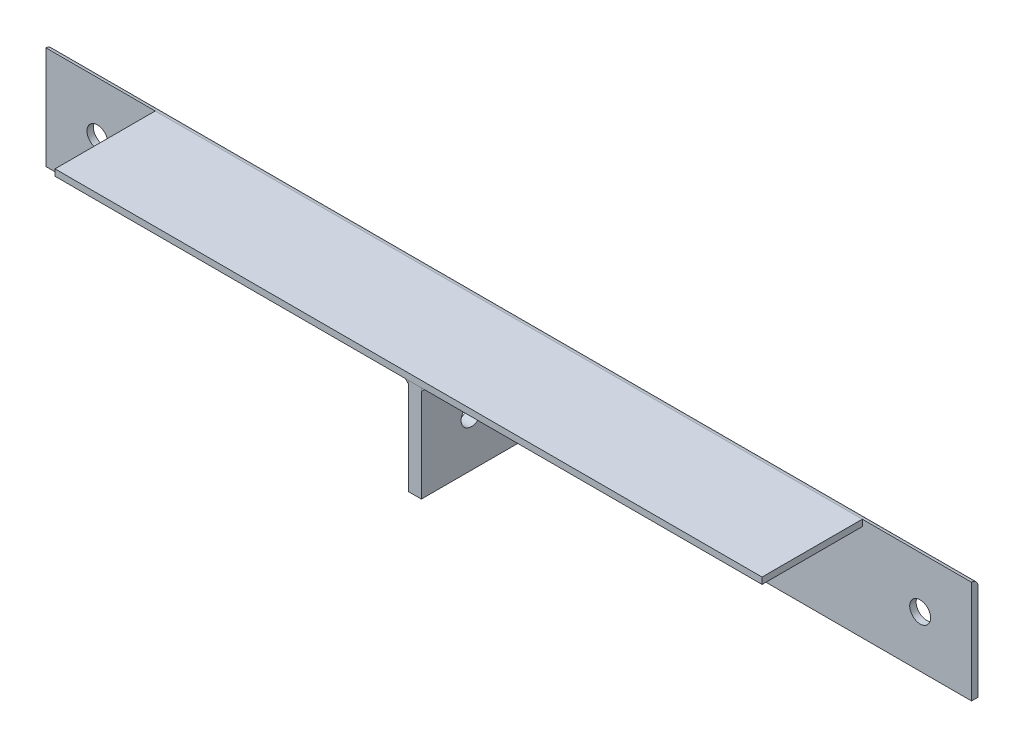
SolidWorks part; units mm, degrees
other "DetailItem1"
ref_plane "Front Plane" through (0, 0, 0) normal (0, 0, 1) x (1, 0, 0)
ref_plane "Top Plane" through (0, 0, 0) normal (0, 1, 0) x (1, 0, 0)
ref_plane "Right Plane" through (0, 0, 0) normal (1, 0, 0) x (0, 0, -1)
sketch "Sketch1" plane through (0, 0, 0) normal (0, 0, 1) x (1, 0, 0)
  line L1 (0, 0) -> (-914.4, 0)
  line L2 (0, 0) -> (0, -101.6)
  line L3 (0, -101.6) -> (-914.4, -101.6)
  line L4 (-914.4, 0) -> (-914.4, -101.6)
  dimension "D1" = 914.4
  dimension "D2" = 101.6
extrude "Extrude1" add sketch "Sketch1" along normal blind 6.35
sketch "Sketch2" plane through (0, 0, 6.35) normal (0, 0, 1) x (1, 0, 0)
  line L0 (0, -101.6) -> (0, 0) construction
  line L1 (0, 0) -> (-914.4, 0) construction
  circle A0 centre (-863.6, -50.8) radius 10.3188
  dimension "D1" = 20.6375
  dimension "D2" = 863.6
  dimension "D3" = 50.8
extrude "Cut-Extrude1" cut sketch "Sketch2" against normal blind 6.35
sketch "Sketch3" plane through (0, 0, 6.35) normal (0, 0, 1) x (1, 0, 0)
  line L0 (0, -101.6) -> (0, 0) construction
  line L1 (0, 0) -> (-914.4, 0) construction
  circle A0 centre (-50.8, -50.8) radius 10.3188
  dimension "D1" = 20.6375
  dimension "D2" = 50.8
  dimension "D3" = 50.8
extrude "Cut-Extrude2" cut sketch "Sketch3" against normal blind 6.35
sketch "Sketch4" plane through (0, 0, 6.35) normal (0, 0, 1) x (1, 0, 0)
  line L0 (0, 0) -> (-914.4, 0) construction
  line L1 (-107.95, 0) -> (-806.45, 0)
  line L2 (-107.95, 0) -> (-107.95, -6.35)
  line L3 (-107.95, -6.35) -> (-806.45, -6.35)
  line L4 (-806.45, 0) -> (-806.45, -6.35)
  line L5 (0, -101.6) -> (0, 0) construction
  dimension "D1" = 107.95
  dimension "D2" = 806.45
  dimension "D3" = 6.35
extrude "Extrude2" add sketch "Sketch4" along normal blind 99.06
fillet "Fillet1" radius 6.35 1 edges at (-457.2, 0, 0)
sketch "Sketch6" plane through (0, 0, 6.35) normal (0, 0, 1) x (1, 0, 0)
  line L0 (-914.4, -101.6) -> (0, -101.6) construction
  line L1 (-457.2, -101.6) -> (-444.5, -101.6)
  line L2 (-457.2, -101.6) -> (-457.2, -6.35)
  line L3 (-457.2, -6.35) -> (-444.5, -6.35)
  line L4 (-444.5, -101.6) -> (-444.5, -6.35)
  line L5 (0, -101.6) -> (0, 0) construction
  line L6 (0, 0) -> (-107.95, 0) construction
  dimension "D1" = 444.5
  dimension "D2" = 6.35
extrude "Extrude3" add sketch "Sketch6" along normal blind 99.06 separate body
other "Fillet Bead1" parameters "D10"=6.35, "D11"=3.175, "D12"=0, "D13"=3.175, "D14"=0
sketch "Sketch8" plane through (-457.2, 0, 0) normal (-1, 0, 0) x (0, 0, 1)
  line L0 (105.41, -6.35) -> (105.41, -101.6) construction
  line L1 (105.41, -6.35) -> (6.35, -6.35) construction
  circle A0 centre (55.88, -53.975) radius 10.3187
  dimension "D1" = 20.6375
  dimension "D2" = 49.53
  dimension "D3" = 47.625
extrude "Cut-Extrude3" cut sketch "Sketch8" against normal up to next
